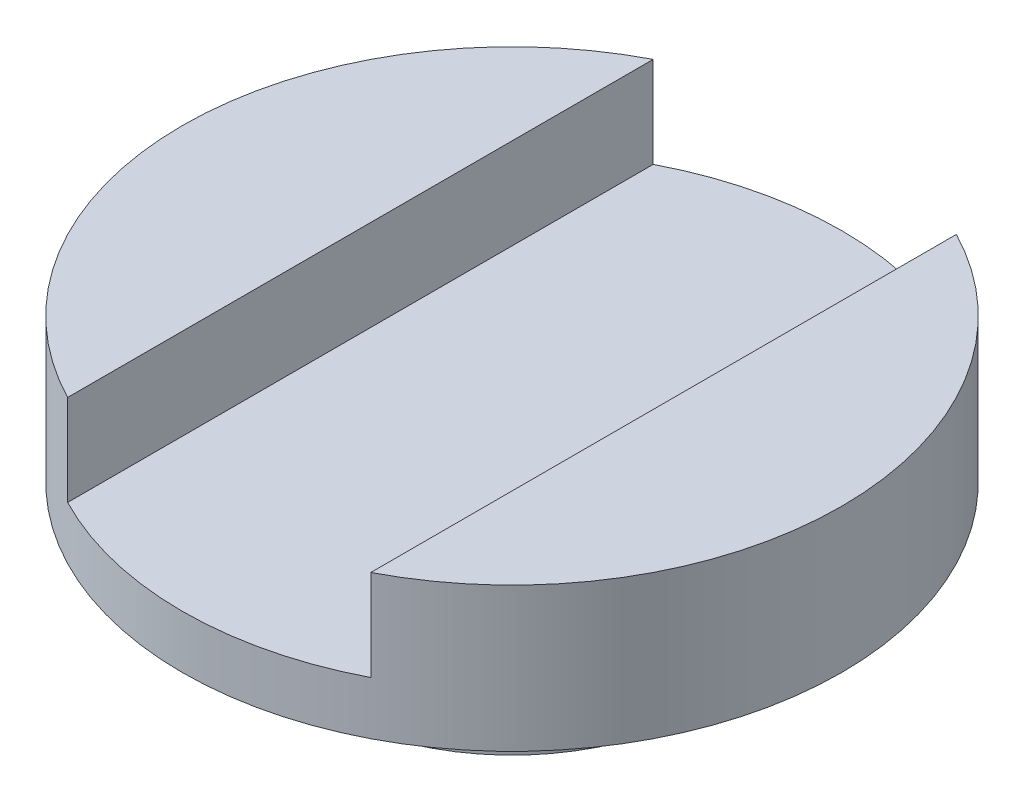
SolidWorks part; units mm, degrees
ref_plane "Front Plane" through (0, 0, 0) normal (0, 0, 1) x (1, 0, 0)
ref_plane "Top Plane" through (0, 0, 0) normal (0, 1, 0) x (1, 0, 0)
ref_plane "Right Plane" through (0, 0, 0) normal (1, 0, 0) x (0, 0, -1)
sketch "Sketch1" plane through (0, 0, 0) normal (0, 0, 1) x (1, 0, 0)
  line L0 (0, 0) -> (0, 50.835) construction
  line L1 (0, 0) -> (25.375, 0)
  line L2 (25.375, 0) -> (25.375, 2)
  line L3 (25.375, 2) -> (21.5645, 8.6)
  line L4 (22.9501, 11) -> (25.375, 11)
  line L5 (25.375, 11) -> (25.375, 13.25)
  line L6 (25.375, 13.25) -> (43.5, 13.25)
  line L7 (43.5, 13.25) -> (43.5, 32.25)
  line L8 (43.5, 32.25) -> (0, 32.25)
  line L9 (0, 32.25) -> (0, 0)
  arc A0 (21.5645, 8.6) -> (22.9501, 11) centre (22.9501, 9.4) cw
  dimension "D8" = 1.6
  dimension "D1" = 2
  dimension "D2" = 50.75
  dimension "D3" = 11
  dimension "D4" = 150
  dimension "D5" = 2.25
  dimension "D6" = 87
  dimension "D7" = 19
revolve "Revolve1" add sketch "Sketch1" angle 360 about L0
sketch "Sketch2" plane through (0, 0, 0) normal (0, 0, 1) x (1, 0, 0)
  line L0 (0, 0) -> (0, 54.0091) construction
  line L1 (43.5, 32.25) -> (-43.5, 32.25) construction
  line L2 (-20, 32.25) -> (20, 32.25)
  line L3 (-20, 32.25) -> (-20, 20.25)
  line L4 (-20, 20.25) -> (20, 20.25)
  line L5 (20, 32.25) -> (20, 20.25)
  dimension "D1" = 40
  dimension "D2" = 12
extrude "Cut-Extrude1" cut sketch "Sketch2" against normal through all and the other way through all
